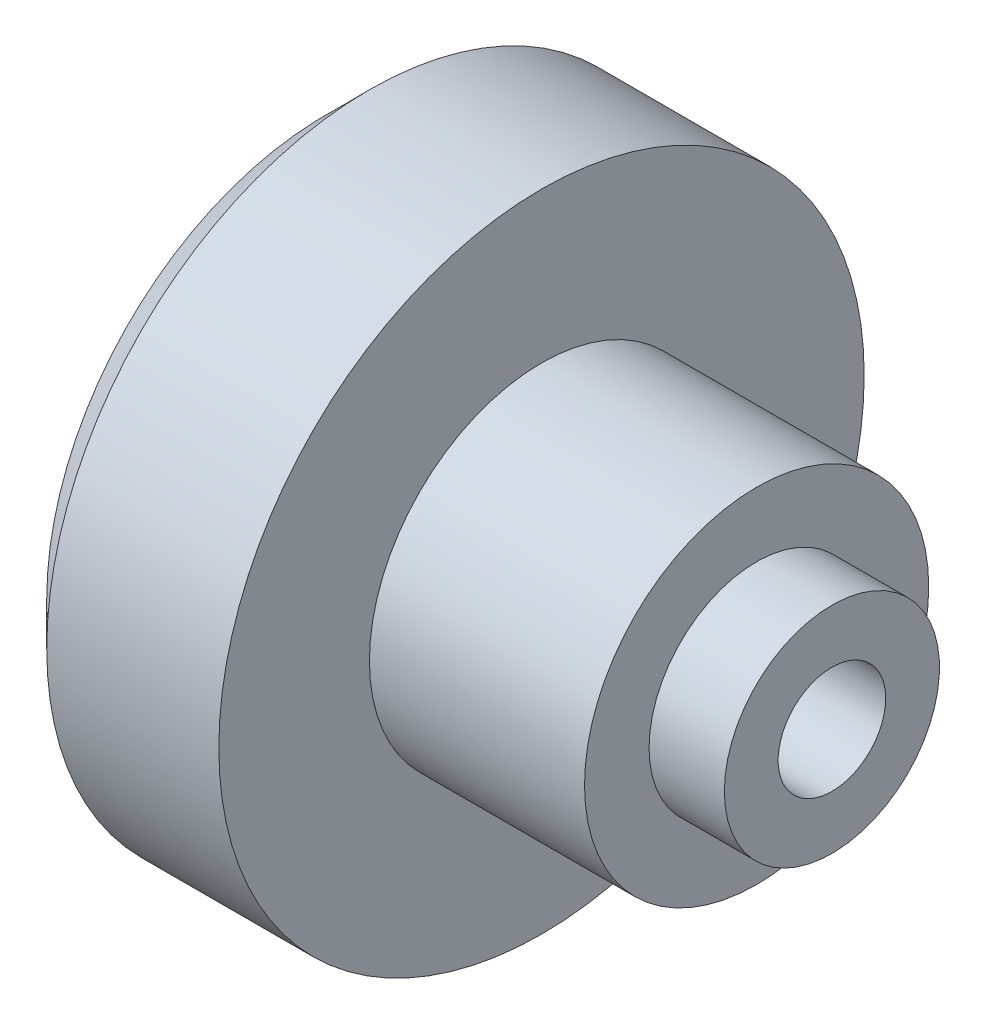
SolidWorks part; units mm, degrees
ref_plane "Front Plane" through (0, 0, 0) normal (0, 0, 1) x (1, 0, 0)
ref_plane "Top Plane" through (0, 0, 0) normal (0, 1, 0) x (1, 0, 0)
ref_plane "Right Plane" through (0, 0, 0) normal (1, 0, 0) x (0, 0, -1)
sketch "Sketch1" plane through (0, 0, 0) normal (0, 0, 1) x (1, 0, 0)
  line L0 (0, 0) -> (23.5, 0) construction
  line L1 (0, 0) -> (0, 15)
  line L2 (0, 15) -> (10, 15)
  line L3 (10, 15) -> (10, 8)
  line L4 (10, 8) -> (20, 8)
  line L5 (20, 8) -> (20, 5)
  line L6 (20, 5) -> (23.5, 5)
  line L7 (23.5, 5) -> (23.5, 0)
  line L8 (0, 0) -> (23.5, 0)
  dimension "D1" = 15
  dimension "D2" = 5
  dimension "D3" = 8
  dimension "D4" = 10
  dimension "D5" = 10
  dimension "D6" = 3.5
revolve "Revolve1" add sketch "Sketch1" angle 360 about L0
sketch "Sketch2" plane through (23.5, 0, 0) normal (1, 0, 0) x (0, 0, -1)
  point P0 (0, 0)
hole_wizard "M6 Tapped Hole1" positions "3DSketch1" profile "Sketch4" tap size "M6" standard "ISO"
sketch3d "3DSketch1"
  point P0 (23.5, 0, 0)
sketch "Sketch4" plane through (23.5, 0, 0) normal (0, 1, 0) x (0, 0, -1)
  line L0 (0, 0) -> (0, 16.5022)
  line L1 (0, 16.5022) -> (2.5, 15)
  line L2 (2.5, 15) -> (2.5, 0)
  line L5 (2.5, 0) -> (0, 0)
  line L10 (0, 16.5022) -> (-2.5, 15) construction
  line L11 (0, -6.35) -> (0, 107.95) construction
  dimension "Tap Drill Dia." = 5
  dimension "Tap Drill Depth" = 15
  dimension "Drill Angle" = 118
chamfer "Chamfer1" distance 2 angle 45 1 edges at (0, 0, 15)
